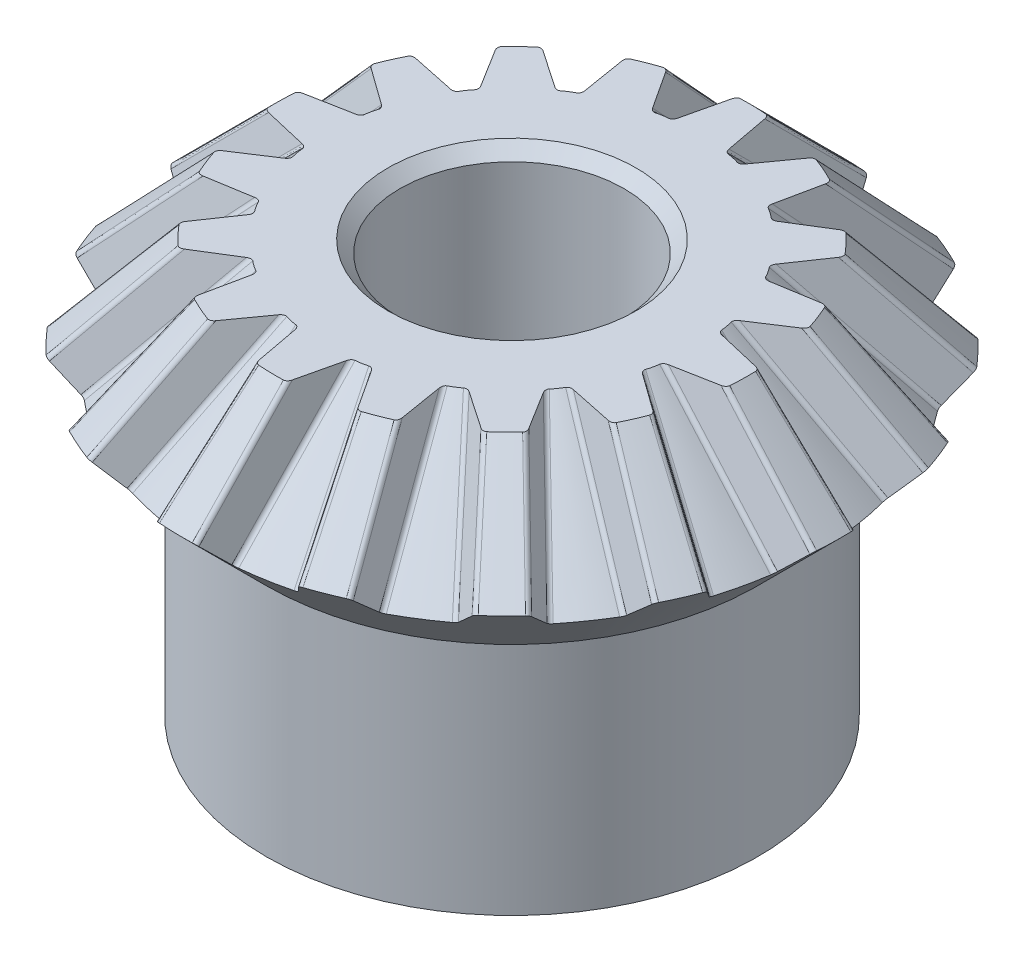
SolidWorks part; units mm, degrees
ref_plane "Front" through (0, 0, 0) normal (0, 0, 1) x (1, 0, 0)
ref_plane "Top" through (0, 0, 0) normal (0, 1, 0) x (1, 0, 0)
ref_plane "Right" through (0, 0, 0) normal (1, 0, 0) x (0, 0, -1)
imported_body "Imported1"
sketch "Sketch1" plane through (0, 4.3656, 0) normal (0, 1, 0) x (1, 0, 0)
  circle A0 centre (0, 0) radius 6.35 construction
  dimension "D1" = 12.7
sketch "Sketch2" plane through (0, 0.4096, 0) normal (0, 1, 0) x (1, 0, 0)
  circle A0 centre (0, 0) radius 5.207 construction
  circle A1 centre (0, 0) radius 5.207
extrude "Boss-Extrude1" add sketch "Sketch2" along normal up to next
sketch "Sketch3" plane through (0, 4.3656, 0) normal (0, 1, 0) x (-1, 0, 0)
  circle A0 centre (0, 0) radius 6.35 construction
  dimension "D1" = 12.7
sketch "Sketch4" plane through (0, 0, 0) normal (0, 0, 1) x (1, 0, 0)
  line L0 (3.8683, 3.2266) -> (5.848, 1.2506)
  line L1 (5.848, 1.2506) -> (7.6245, 3.0271)
  line L2 (7.6245, 3.0271) -> (12.7, 3.0312)
  line L3 (12.7, 3.0312) -> (12.7, 13.434)
  line L4 (12.7, 13.434) -> (7.6357, 13.434)
  line L5 (7.6357, 13.434) -> (5.8463, 15.1976)
  line L6 (3.8683, 3.2266) -> (3.8683, 13.2237)
  line L7 (3.8683, 13.2237) -> (5.8463, 15.1976)
  line L8 (0, 0) -> (12.7, 0) construction
  line L9 (5.207, 0.6096) -> (6.985, 2.3876) construction
  dimension "D1" = 12.7
